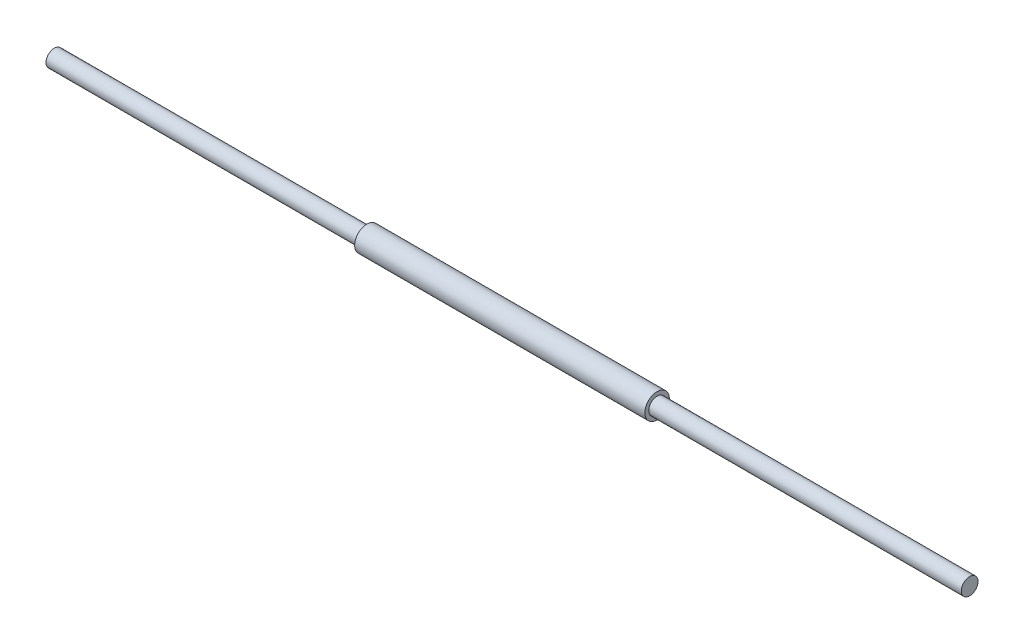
SolidWorks part; units mm, degrees
ref_plane "Front Plane" through (0, 0, 0) normal (0, 0, 1) x (1, 0, 0)
ref_plane "Top Plane" through (0, 0, 0) normal (0, 1, 0) x (1, 0, 0)
ref_plane "Right Plane" through (0, 0, 0) normal (1, 0, 0) x (0, 0, -1)
sketch "Sketch1" plane through (0, 0, 0) normal (0, 0, 1) x (1, 0, 0)
  line L0 (-260.35, 0) -> (260.35, 0)
  line L1 (82.55, 4.7625) -> (82.55, 6.985)
  line L2 (82.55, 6.985) -> (-82.55, 6.985)
  line L3 (-82.55, 6.985) -> (-82.55, 4.7625)
  line L4 (0, 6.985) -> (0, 0) construction
  line L7 (82.55, 4.7625) -> (260.35, 4.7625)
  line L10 (-82.55, 4.7625) -> (-260.35, 4.7625)
  line L11 (-260.35, 0) -> (-260.35, 4.7625)
  line L12 (260.35, 0) -> (260.35, 4.7625)
  dimension "D1" = 165.1
  dimension "D2" = 177.8
  dimension "D3" = 6.985
  dimension "D4" = 4.7625
  dimension "D5" = 4.7625
  dimension "D6" = 177.8
revolve "Revolve1" add sketch "Sketch1" angle 360 about L0
